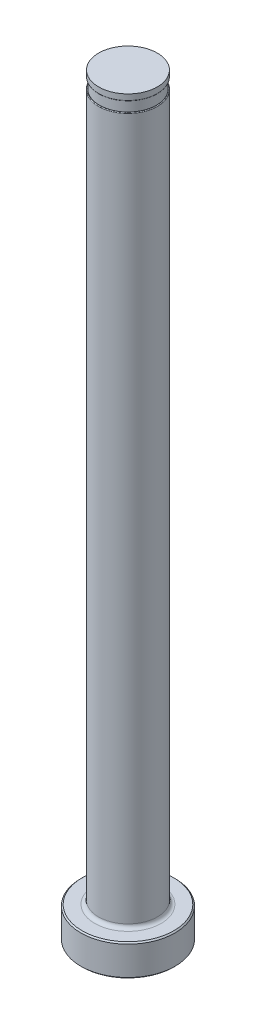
SolidWorks part; units mm, degrees
ref_plane "Front Plane" through (0, 0, 0) normal (0, 0, 1) x (1, 0, 0)
ref_plane "Top Plane" through (0, 0, 0) normal (0, 1, 0) x (1, 0, 0)
ref_plane "Right Plane" through (0, 0, 0) normal (1, 0, 0) x (0, 0, -1)
other "Configuration Table"
sketch "Sketch1" plane through (0, 0, 0) normal (0, 0, 1) x (1, 0, 0)
  line L0 (0, 259.9588) -> (0, -15.1925) construction
  line L1 (0, 0) -> (-9.525, 0)
  line L2 (-9.525, 0) -> (-9.525, 6.35)
  line L3 (-9.525, 6.35) -> (-5.9525, 6.35)
  line L4 (-5.9525, 6.35) -> (-5.9525, 152.4)
  line L5 (-5.9525, 152.4) -> (0, 152.4)
  line L6 (0, 152.4) -> (0, 0)
  dimension "L" = 152.4
  dimension "H" = 19.05
  dimension "T" = 6.35
  dimension "D" = 11.905
revolve "Revolve1" add sketch "Sketch1" angle 360 about L0
chamfer "Chamfer1" distance 0.254 angle 45 2 edges at (0, 6.35, 9.525) (0, 0, 9.525)
fillet "Fillet1" radius 0.762 1 edges at (0, 6.35, 5.9525)
sketch "Sketch2" plane through (0, 0, 0) normal (0, 0, 1) x (1, 0, 0)
  line L0 (-5.9525, 152.4) -> (-5.9525, 7.112) construction
  line L1 (-5.9525, 151.13) -> (-5.7493, 151.13)
  line L2 (-5.9525, 151.13) -> (-5.9525, 149.098)
  line L3 (-5.9525, 149.098) -> (-5.7493, 149.098)
  line L4 (-5.7493, 151.13) -> (-5.7493, 149.098)
  line L5 (5.9525, 152.4) -> (-5.9525, 152.4) construction
  line L6 (0, 153.4483) -> (0, 147.3282) construction
  dimension "D1" = 2.032
  dimension "N" = 1.27
  dimension "FD" = 0.2032
  dimension "D3" = 11.4986
revolve "Vent Relief" cut sketch "Sketch2" angle 360 about L6
sketch "Sketch3" plane through (0, 0, 0) normal (0, 0, 1) x (1, 0, 0)
  line L0 (-5.7493, 150.114) -> (-5.7493, 86.614)
  line L1 (-5.7493, 151.13) -> (-5.7493, 149.098) construction
  line L2 (-5.9525, 149.098) -> (-5.9525, 7.112) construction
  line L3 (-5.9525, 85.4964) -> (-5.9525, 150.114)
  line L4 (-5.9525, 150.114) -> (-5.7493, 150.114)
  arc A0 (-5.7493, 86.614) -> (-5.9525, 85.4964) centre (-8.9243, 86.614) cw
  dimension "D1" = 3.175
  dimension "D2" = 63.5
extrude "D-Slot" cut sketch "Sketch3" against normal through all both and the other way through all
sketch "Sketch5" plane through (0, 0, 0) normal (0, 0, 1) x (1, 0, 0)
  line L0 (-5.9525, 151.13) -> (5.9525, 151.13) construction
  line L1 (-5.9525, 152.4) -> (-5.9334, 152.4)
  line L2 (-5.9525, 152.4) -> (-5.9525, 151.13)
  line L3 (-5.9525, 151.13) -> (-5.9334, 151.13)
  line L4 (-5.9334, 152.4) -> (-5.9334, 151.13)
  line L5 (0, 152.6877) -> (0, 150.5771) construction
  dimension "VP" = 0.019
revolve "Vent Diameter" cut sketch "Sketch5" angle 360 about L5
fillet "Fillet2" radius 0.127 2 edges at (5.9525, 149.098, 0) (0, 151.13, 5.9334)
sketch "Pocket Sketch" plane through (0, 0, 0) normal (0, 0, 1) x (1, 0, 0)
  line L0 (-9.9219, 0) -> (-9.9219, 6.3754)
  line L1 (-9.9219, 6.3754) -> (-6.9129, 6.3754)
  line L2 (-6.1509, 7.1374) -> (-6.1509, 22.225)
  line L3 (-6.1509, 22.225) -> (0, 22.225)
  line L4 (0, 22.225) -> (0, 0)
  line L5 (0, 0) -> (-9.9219, 0)
  line L6 (0, 12.6104) -> (0, -2.4989) construction
  line L7 (-9.525, 6.096) -> (-9.525, 0.254) construction
  line L8 (9.271, 6.35) -> (-9.271, 6.35) construction
  line L9 (-5.9525, 85.4964) -> (-5.9525, 7.112) construction
  line L10 (-6.9129, 6.3754) -> (-6.1509, 7.1374)
  point P3 (-6.1509, 6.3754)
  dimension "D1" = 19.8437
  dimension "D2" = 0.3969
  dimension "D3" = 0.0254
  dimension "D4" = 0.1984
  dimension "D5" = 12.3019
  dimension "D6" = 22.225
